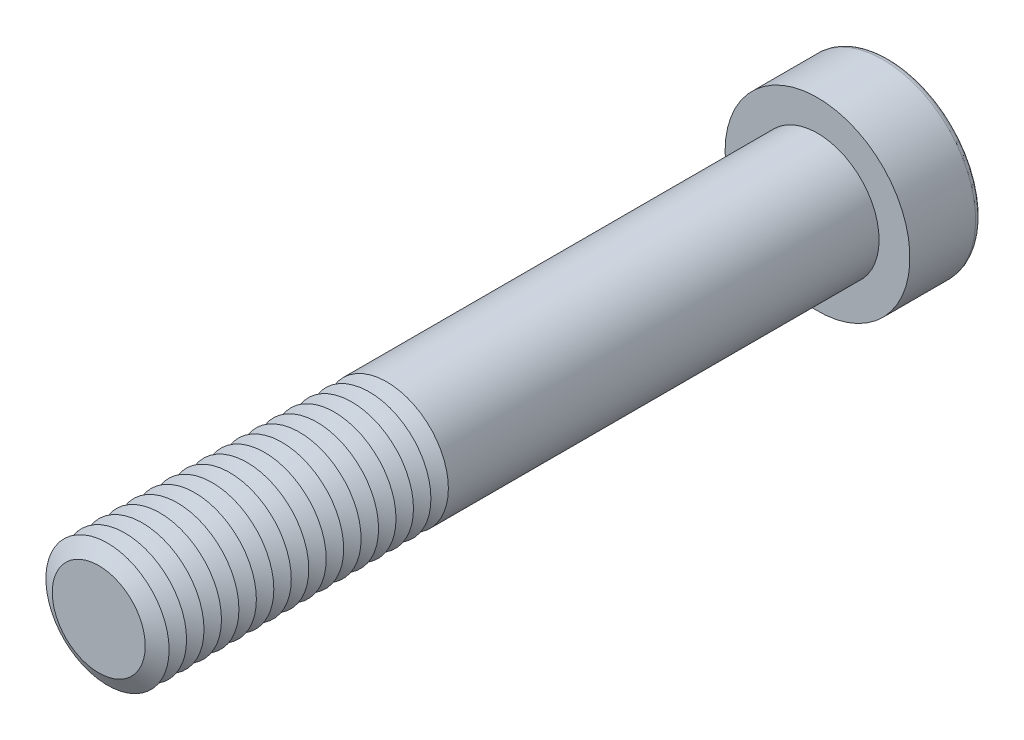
SolidWorks part; units mm, degrees
ref_plane "Front Plane" through (0, 0, 0) normal (0, 0, 1) x (1, 0, 0)
ref_plane "Top Plane" through (0, 0, 0) normal (0, 1, 0) x (1, 0, 0)
ref_plane "Right Plane" through (0, 0, 0) normal (1, 0, 0) x (0, 0, -1)
sketch "Sketch1" plane through (0, 0, 0) normal (0, 0, 1) x (1, 0, 0)
  circle A0 centre (0, 0) radius 6
  dimension "D1" = 12
extrude "Boss-Extrude1" add sketch "Sketch1" along normal blind 70
sketch "Sketch2" plane through (0, 0, 0) normal (0, 0, -1) x (-1, 0, 0)
  circle A0 centre (0, 0) radius 9
  dimension "D1" = 18
extrude "Boss-Extrude2" add sketch "Sketch2" along normal blind 7
sketch "Sketch3" plane through (0, 0, -7) normal (0, 0, -1) x (-1, 0, 0)
  line L1 (-2.3094, 4) -> (-4.6188, 0)
  line L2 (-4.6188, 0) -> (-2.3094, -4)
  line L3 (-2.3094, -4) -> (2.3094, -4)
  line L4 (2.3094, -4) -> (4.6188, 0)
  line L5 (4.6188, 0) -> (2.3094, 4)
  line L6 (2.3094, 4) -> (-2.3094, 4)
  circle A0 centre (0, 0) radius 4 construction
  dimension "D1" = 8
extrude "Cut-Extrude1" cut sketch "Sketch3" against normal blind 6
fillet "Fillet1" radius 0.6 1 edges at (-9, 0, -7)
sketch "Sketch4" plane through (0, 0, -1) normal (0, 0, -1) x (-1, 0, 0)
  line L0 (2.3094, -4) -> (4.6188, 0) construction
  circle A0 centre (0, 0) radius 4
extrude "Cut-Extrude2" cut sketch "Sketch4" against normal through all draft 60
sketch "Sketch5" plane through (0, 0, -7) normal (0, 0, -1) x (-1, 0, 0)
  circle A0 centre (0, 0) radius 4.6188
extrude "Cut-Extrude3" cut sketch "Sketch5" against normal through all draft 75
sketch "Sketch7" plane through (0, 0, 0) normal (1, 0, 0) x (0, 0, -1)
  line L25 (-70, 4.5278) -> (-69.15, 6)
  line L26 (-70, 6) -> (-70, -6) construction
  line L27 (-69.15, 6) -> (-70.85, 6)
  line L28 (-70.85, 6) -> (-70, 4.5278)
  line L29 (0, 6) -> (-70, 6) construction
  dimension "D1" = 1.7
revolve "Cut-Revolve1" cut sketch "Sketch7" angle 360 about axis through (0, 0, 70) along (0, 0, -1)
pattern_linear "LPattern1" count 17 spacing 1.7 along (0, 0, -1) of "Cut-Revolve1"
